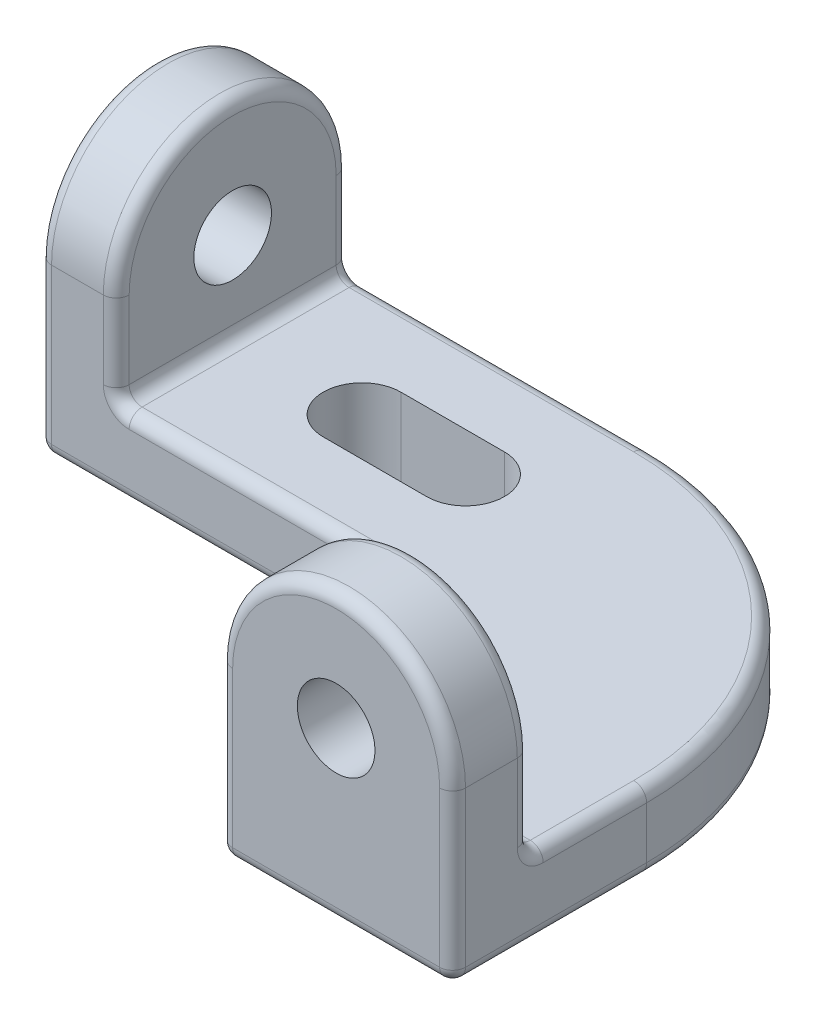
SolidWorks part; units mm, degrees
ref_plane "Front Plane" through (0, 0, 0) normal (0, 0, 1) x (1, 0, 0)
ref_plane "Top Plane" through (0, 0, 0) normal (0, 1, 0) x (1, 0, 0)
ref_plane "Right Plane" through (0, 0, 0) normal (1, 0, 0) x (0, 0, -1)
imported_body "Imported1"
ref_plane "Plane1" through (0, 0, 15.875) normal (0, 0, 1) x (1, 0, 0)
split "Split1" trim tools "Plane1" bodies to split 101 resulting bodies 102 103
move or copy body "Body-Move/Copy1" bodies to move or copy 102 placed by mates yes
other "Distance1" parameters "D1"=19.05
sketch "Sketch1" plane through (0, 0, 15.875) normal (0, 0, 1) x (1, 0, 0)
  line L4 (107.95, 15.875) -> (107.95, 3.175)
  line L5 (111.125, 0) -> (161.925, 0)
  line L6 (165.1, 3.175) -> (165.1, 15.875)
  line L7 (161.925, 19.05) -> (111.125, 19.05)
  line L8 (107.95, 15.875) -> (107.95, 3.175)
  line L9 (111.125, 0) -> (161.925, 0)
  line L10 (165.1, 3.175) -> (165.1, 15.875)
  line L11 (161.925, 19.05) -> (111.125, 19.05)
  arc A4 (111.125, 19.05) -> (107.95, 15.875) centre (111.125, 15.875) ccw
  arc A5 (107.95, 3.175) -> (111.125, 0) centre (111.125, 3.175) ccw
  arc A6 (161.925, 0) -> (165.1, 3.175) centre (161.925, 3.175) ccw
  arc A7 (165.1, 15.875) -> (161.925, 19.05) centre (161.925, 15.875) ccw
  arc A8 (111.125, 19.05) -> (107.95, 15.875) centre (111.125, 15.875) ccw
  arc A9 (107.95, 3.175) -> (111.125, 0) centre (111.125, 3.175) ccw
  arc A10 (161.925, 0) -> (165.1, 3.175) centre (161.925, 3.175) ccw
  arc A11 (165.1, 15.875) -> (161.925, 19.05) centre (161.925, 15.875) ccw
  dimension "D1" = 0
extrude "Boss-Extrude1" add sketch "Sketch1" along normal up to next
